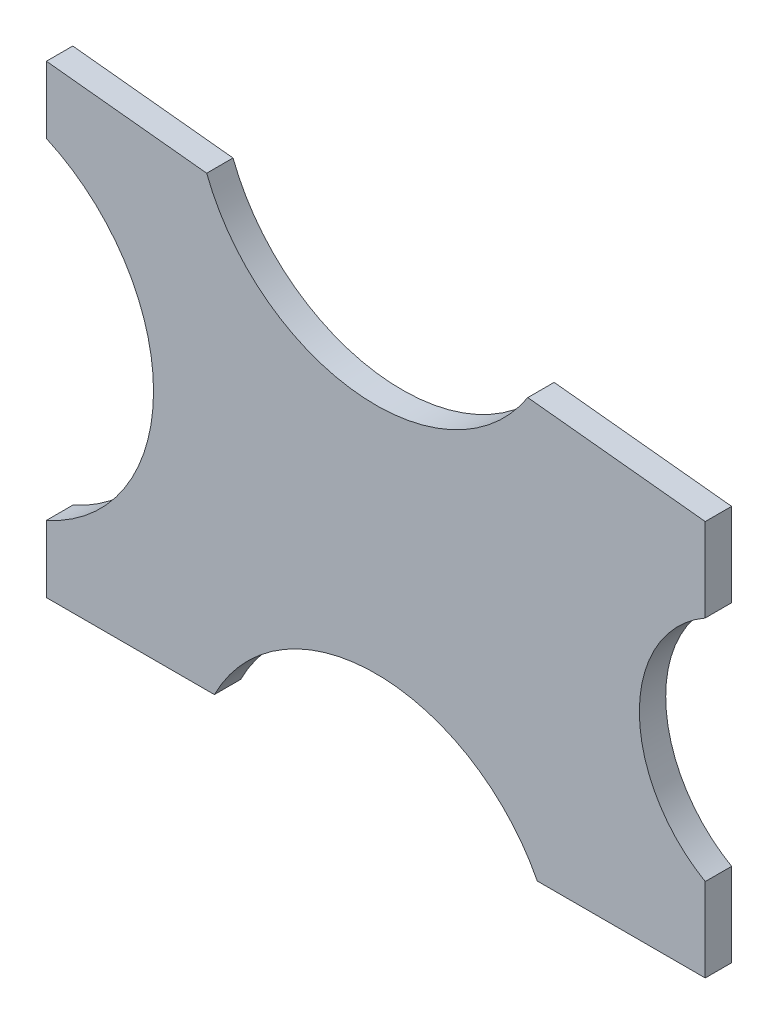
SolidWorks part; units mm, degrees
ref_plane "Front Plane" through (0, 0, 0) normal (0, 0, 1) x (1, 0, 0)
ref_plane "Top Plane" through (0, 0, 0) normal (0, 1, 0) x (1, 0, 0)
ref_plane "Right Plane" through (0, 0, 0) normal (1, 0, 0) x (0, 0, -1)
sketch "Sketch1" plane through (0, 0, 0) normal (0, 0, 1) x (1, 0, 0)
  line L0 (0, 0) -> (0, 38.1)
  line L1 (0, 38.1) -> (-63.5, 44.7741)
  line L2 (-63.5, 44.7741) -> (-63.5, 0)
  line L3 (-63.5, 0) -> (0, 0)
  line L4 (-63.5, 22.3871) -> (-70.6374, 22.3871) construction
  circle A0 centre (-70.6374, 22.3871) radius 17.4625
  circle A1 centre (-31.75, -7.9248) radius 17.4625
  circle A2 centre (-31.75, 49.4055) radius 17.4625
  circle A3 centre (6.35, 19.05) radius 12.7
  dimension "D5" = 34.925
  dimension "D10" = 25.4
  dimension "D1" = 38.1
  dimension "D2" = 6
  dimension "D3" = 63.5
  dimension "D4" = 7.9248
  dimension "D6" = 49.4055
  dimension "D7" = 7.1374
  dimension "D9" = 31.75
  dimension "D11" = 19.05
  dimension "D12" = 6.35
  dimension "D13" = 7.9248
sketch "Sketch2" plane through (0, 0, 0) normal (0, 0, 1) x (1, 0, 0)
  line L0 (-63.5, 0) -> (0, 0) construction
  line L1 (0, 0) -> (0, 38.1) construction
  line L2 (0, 38.1) -> (-63.5, 44.7741) construction
  line L3 (-63.5, 44.7741) -> (-63.5, 0) construction
  line L4 (-63.5, 0) -> (-47.3107, 0)
  line L5 (0, 0) -> (0, 8.0515)
  line L6 (0, 38.1) -> (-17.1029, 39.8976)
  line L7 (-63.5, 44.7741) -> (-63.5, 38.3243)
  line L8 (-48.0539, 43.1507) -> (-63.5, 44.7741)
  line L9 (-16.1893, 0) -> (0, 0)
  line L10 (-63.5, 6.4498) -> (-63.5, 0)
  line L11 (0, 30.0485) -> (0, 38.1)
  circle A0 centre (-31.75, -7.9248) radius 17.4625 construction
  circle A1 centre (-70.6374, 22.3871) radius 17.4625 construction
  circle A2 centre (-31.75, 49.4055) radius 17.4625 construction
  arc A3 (-16.1893, 0) -> (-47.3107, 0) centre (-31.75, -7.9248) ccw
  arc A4 (-63.5, 6.4498) -> (-63.5, 38.3243) centre (-70.6374, 22.3871) ccw
  arc A5 (-48.0539, 43.1507) -> (-17.1029, 39.8976) centre (-31.75, 49.4055) ccw
  circle A6 centre (6.35, 19.05) radius 12.7 construction
  arc A7 (0, 30.0485) -> (0, 8.0515) centre (6.35, 19.05) ccw
extrude "Boss-Extrude1" add sketch "Sketch2" along normal blind 2.54
